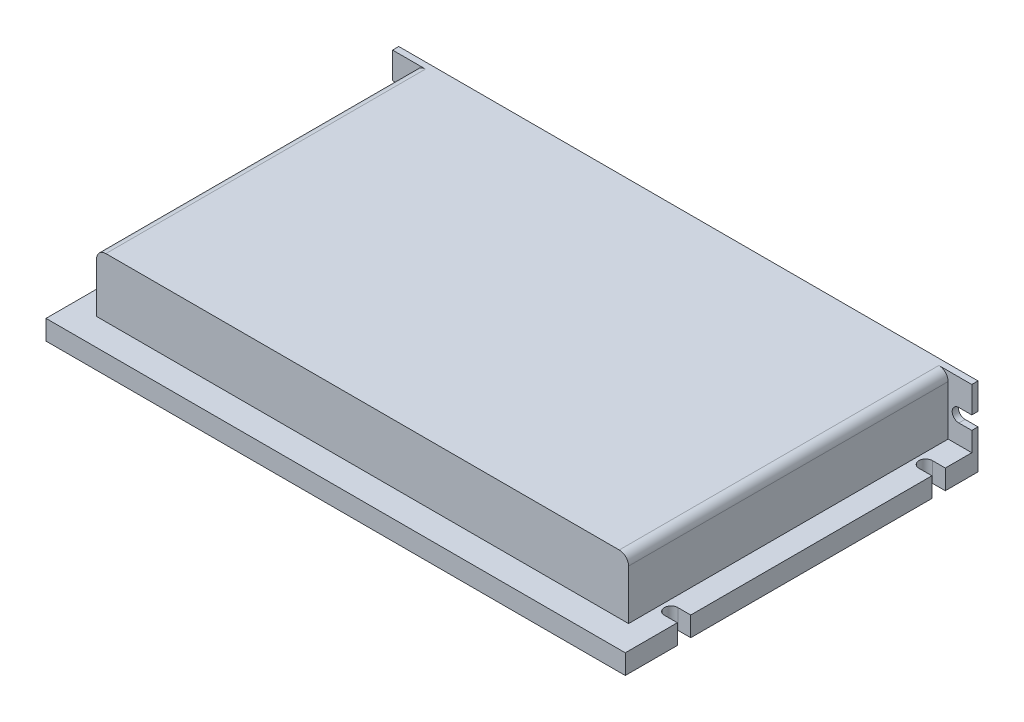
SolidWorks part; units mm, degrees
ref_plane "Plan1" through (0, 0, 0) normal (0, 0, 1) x (1, 0, 0)
ref_plane "Plan2" through (0, 0, 0) normal (0, 1, 0) x (1, 0, 0)
ref_plane "Plan3" through (0, 0, 0) normal (1, 0, 0) x (0, 0, -1)
sketch "Esquisse1" plane through (0, 0, 0) normal (0, 0, 1) x (1, 0, 0)
  line L0 (-60, 10) -> (126.69, 10)
  line L1 (-60, 10) -> (-60, 1.485)
  line L2 (126.69, -15.4) -> (-60, -15.4)
  line L3 (126.69, -15.4) -> (126.69, -2.825)
  line L4 (-55.83, 1.485) -> (-60, 1.485)
  line L5 (-55.83, -2.825) -> (-60, -2.825)
  line L6 (122.52, 1.485) -> (126.69, 1.485)
  line L7 (122.52, -2.825) -> (126.69, -2.825)
  line L8 (126.69, 1.485) -> (126.69, 10)
  line L9 (-60, -2.825) -> (-60, -15.4)
  arc A0 (-55.83, -2.825) -> (-55.83, 1.485) centre (-55.83, -0.67) ccw
  arc A1 (122.52, 1.485) -> (122.52, -2.825) centre (122.52, -0.67) ccw
  dimension "D3" = 4.31
  dimension "D4" = 4.31
  dimension "D6" = 4.17
  dimension "D7" = 14.73
  dimension "D8" = 14.73
  dimension "D1" = 186.69
  dimension "D2" = 25.4
  dimension "D5" = 4.17
extrude "Base-Extrusion" add sketch "Esquisse1" along normal blind 2
sketch "Esquisse2" plane through (0, 0, 2) normal (0, 0, 1) x (1, 0, 0)
  line L0 (-60, -15.4) -> (126.69, -15.4)
  line L1 (-60, -15.4) -> (-60, -9.05)
  line L2 (126.69, -9.05) -> (-60, -9.05)
  line L3 (126.69, -9.05) -> (126.69, -15.4)
  line L4 (126.69, -15.4) -> (126.69, -2.825) construction
  dimension "D1" = 6.35
extrude "Boss.-Extru.1" add sketch "Esquisse2" along normal blind 111.68
sketch "Esquisse3" plane through (0, 0, 2) normal (0, 0, 1) x (1, 0, 0)
  line L0 (-52.38, -9.05) -> (119.07, -9.05)
  line L1 (-52.38, -9.05) -> (-52.38, 7)
  line L2 (116.07, 10) -> (-49.38, 10)
  line L3 (119.07, 7) -> (119.07, -9.05)
  line L4 (126.69, -9.05) -> (-60, -9.05) construction
  line L5 (-60, 10) -> (126.69, 10) construction
  line L6 (-60, 10) -> (-60, 1.485) construction
  arc A0 (-49.38, 10) -> (-52.38, 7) centre (-49.38, 7) ccw
  arc A1 (119.07, 7) -> (116.07, 10) centre (116.07, 7) ccw
  point P12 (-52.38, 10)
  point P15 (119.07, 10)
  dimension "D3" = 3
  dimension "D4" = 3
  dimension "D1" = 171.45
  dimension "D2" = 7.62
extrude "Boss.-Extru.2" add sketch "Esquisse3" along normal blind 103
sketch "Esquisse4" plane through (0, -9.05, 0) normal (0, 1, 0) x (-1, 0, 0)
  line L0 (-122.52, 2) -> (-122.52, 0) construction
  line L1 (55.83, 2) -> (55.83, 0) construction
  line L3 (-126.69, 113.68) -> (-126.69, 2) construction
  line L5 (60, 113.68) -> (60, 2) construction
  line L6 (60, 0) -> (-126.69, 0) construction
  line L7 (-122.52, 96.9) -> (-126.69, 96.9)
  line L8 (-122.52, 92.58) -> (-126.69, 92.58)
  line L9 (-126.69, 92.58) -> (-126.69, 96.9)
  line L10 (-122.52, 14.86) -> (-126.69, 14.86)
  line L11 (-126.69, 14.86) -> (-126.69, 10.54)
  line L12 (-122.52, 10.54) -> (-126.69, 10.54)
  line L13 (55.83, 10.54) -> (60, 10.54)
  line L14 (55.83, 14.86) -> (60, 14.86)
  line L15 (60, 14.86) -> (60, 10.54)
  line L16 (55.83, 92.58) -> (60, 92.58)
  line L17 (55.83, 96.9) -> (60, 96.9)
  line L18 (60, 96.9) -> (60, 92.58)
  arc A0 (-122.52, 10.54) -> (-122.52, 14.86) centre (-122.52, 12.7) ccw
  arc A1 (-122.52, 92.58) -> (-122.52, 96.9) centre (-122.52, 94.74) ccw
  arc A2 (55.83, 14.86) -> (55.83, 10.54) centre (55.83, 12.7) ccw
  arc A3 (55.83, 96.9) -> (55.83, 92.58) centre (55.83, 94.74) ccw
  dimension "D1" = 4.32
  dimension "D2" = 4.32
  dimension "D3" = 4.32
  dimension "D4" = 4.32
  dimension "D5" = 82.04
  dimension "D6" = 82.04
  dimension "D7" = 4.17
  dimension "D8" = 4.17
  dimension "D9" = 12.7
  dimension "D10" = 12.7
extrude "Enlèv. mat.-Extru.1" cut sketch "Esquisse4" against normal through all
